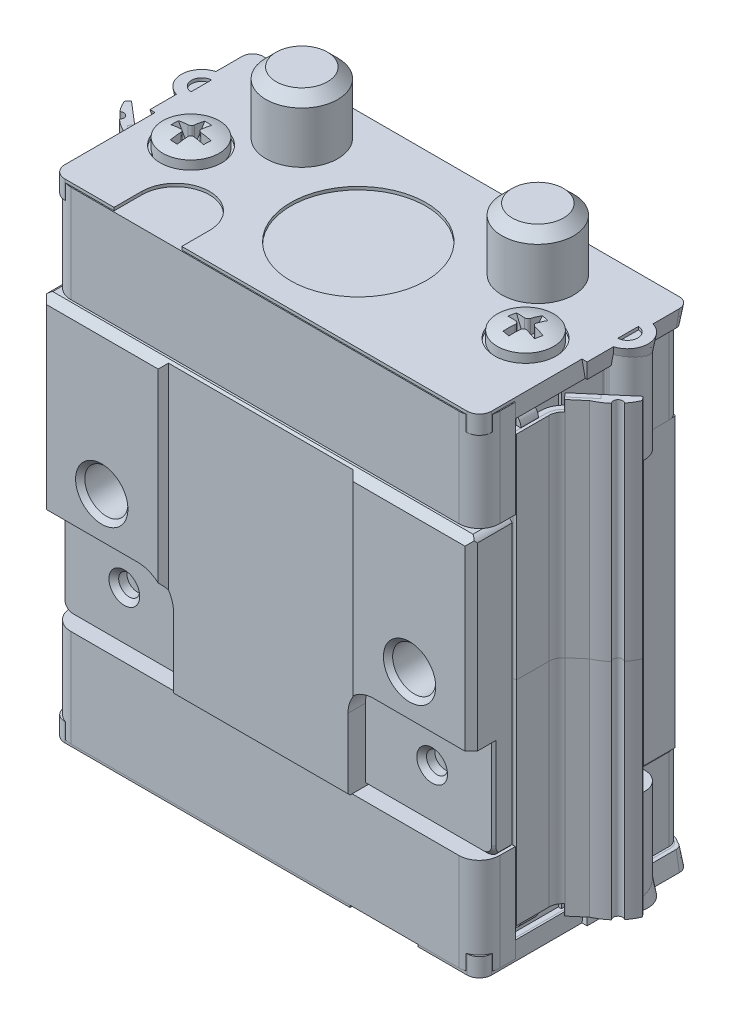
SolidWorks part; units mm, degrees
ref_plane "前视基准面" through (0, 0, 0) normal (0, 0, 1) x (1, 0, 0)
ref_plane "上视基准面" through (0, 0, 0) normal (0, 1, 0) x (1, 0, 0)
ref_plane "右视基准面" through (0, 0, 0) normal (1, 0, 0) x (0, 0, -1)
imported_body "KKR60-SST_W-1-solid1"
imported_body "GB∕T823-M3X14（十字槽小盘头螺钉）-3-solid1"
imported_body "GB∕T823-M3X14（十字槽小盘头螺钉）-4-solid1"
imported_body "KKR60-SSC-P-1-solid1"
imported_body "KKR60-SSC-P-1-solid2"
imported_body "KKR60-SSC-P-1-solid3"
imported_body "KKR60-SSC-P-1-solid4"
imported_body "KKR60-FSD-P-1/KKR60-FSDB-P-1-solid1"
imported_body "KKR60-FSD-P-1/KKR60-FSDJ-P-1-solid1"
imported_body "GB∕T823-M3X14（十字槽小盘头螺钉）-5-solid1"
imported_body "GB∕T823-M3X14（十字槽小盘头螺钉）-6-solid1"
imported_body "KKR60-SSC-P-2-solid1"
imported_body "KKR60-SSC-P-2-solid2"
imported_body "KKR60-SSC-P-2-solid3"
imported_body "KKR60-SSC-P-2-solid4"
imported_body "KKR60-FSD-P-2/KKR60-FSDB-P-1-solid1"
imported_body "KKR60-FSD-P-2/KKR60-FSDJ-P-1-solid1"
imported_body "KKR60-FSFT-P_W-1-solid1"
imported_body "KKR60-FSFT-P_W-2-solid1"
sketch "草图1" plane through (20.9, 0, 0) normal (1, 0, 0) x (0, 0, -1)
  line L0 (-7.1, -23.5) -> (-7.1, -14) construction
  line L1 (-7.1, -16.9147) -> (-5.6, -16.9147)
  line L2 (-7.1, -16.9147) -> (-7.1, -21.3931)
  line L3 (-7.1, -21.3931) -> (-5.6, -21.3931)
  line L4 (-5.6, -16.9147) -> (-5.6, -21.3931)
  line L5 (-5.6, -23.5) -> (-5.6, -14) construction
extrude "切除-拉伸1" cut sketch "草图1" along normal blind 10
sketch "草图2" plane through (-20.9, 0, 0) normal (-1, 0, 0) x (0, 0, 1)
  line L0 (5.6, 22.5) -> (5.6, 15.5) construction
  line L1 (5.6, 21.5908) -> (7.1, 21.5908)
  line L2 (5.6, 21.5908) -> (5.6, 17.3504)
  line L3 (5.6, 17.3504) -> (7.1, 17.3504)
  line L4 (7.1, 21.5908) -> (7.1, 17.3504)
  line L5 (7.1, 23.5) -> (7.1, 14) construction
extrude "切除-拉伸2" cut sketch "草图2" along normal blind 10
